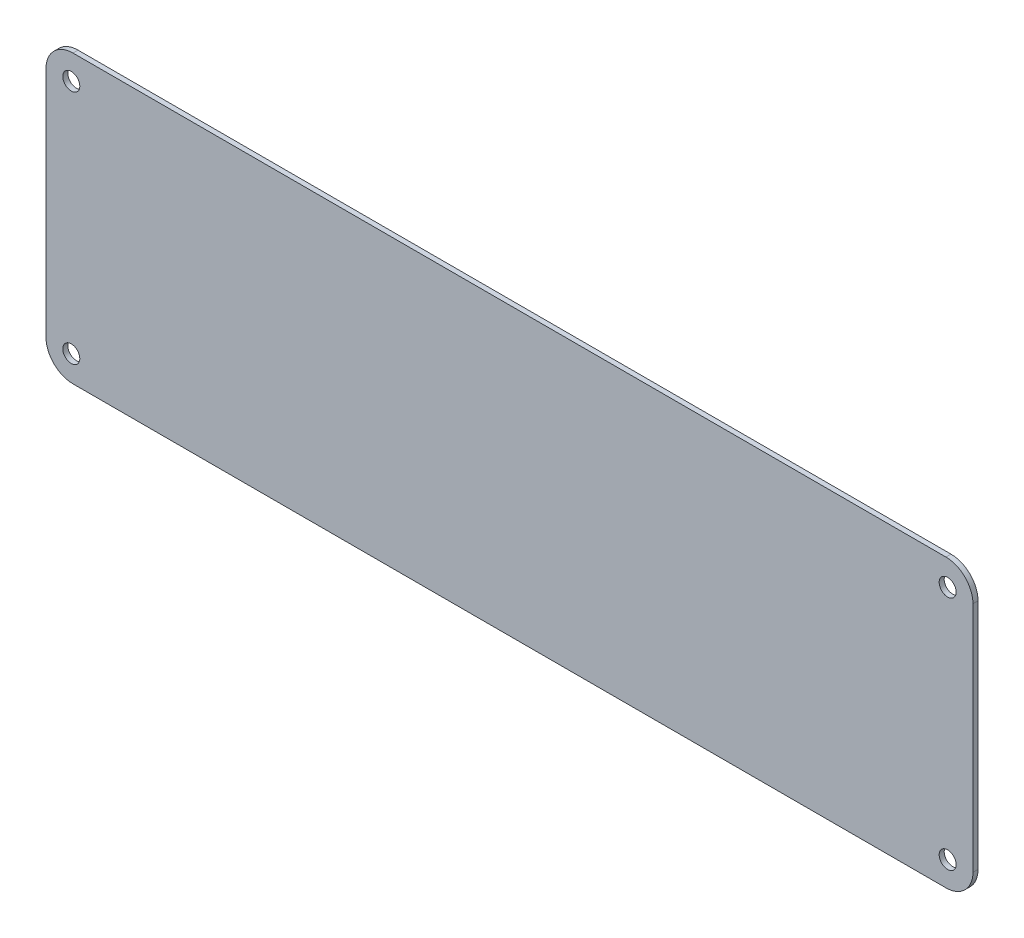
SolidWorks part; units mm, degrees
ref_plane "Ebene vorne" through (0, 0, 0) normal (0, 0, 1) x (1, 0, 0)
ref_plane "Ebene oben" through (0, 0, 0) normal (0, 1, 0) x (1, 0, 0)
ref_plane "Ebene rechts" through (0, 0, 0) normal (1, 0, 0) x (0, 0, -1)
sketch "Skizze1" plane through (0, 0, 0) normal (0, 0, 1) x (1, 0, 0)
  line L1 (-137.5, -42.5) -> (137.5, -42.5)
  line L2 (-137.5, -42.5) -> (-137.5, 42.5)
  line L3 (-137.5, 42.5) -> (137.5, 42.5)
  line L4 (137.5, -42.5) -> (137.5, 42.5)
  line L5 (-137.5, -42.5) -> (137.5, 42.5) construction
  line L6 (-137.5, 42.5) -> (137.5, -42.5) construction
  point P0 (0, 0)
  dimension "D1" = 275
  dimension "D2" = 85
extrude "Aufsatz-Linear austragen1" add sketch "Skizze1" along normal blind 1.5
hole_wizard "Ø5.05 (5.05) Durchmesser Bohrung1" positions "Skizze2" profile "Skizze3" hole size "Ø5.05" standard "DIN"
sketch "Skizze2" plane through (0, 0, 1.5) normal (0, 0, 1) x (1, 0, 0)
  line L1 (-130, -35) -> (130, -35)
  line L2 (-130, -35) -> (-130, 35)
  line L3 (-130, 35) -> (130, 35)
  line L4 (130, -35) -> (130, 35)
  line L5 (-130, -35) -> (130, 35) construction
  line L6 (-130, 35) -> (130, -35) construction
  point P2 (130, 35)
  point P5 (-130, -35)
  point P6 (-130, 35)
  point P7 (130, -35)
  dimension "D1" = 70
  dimension "D2" = 260
sketch "Skizze3" plane through (130, 35, 1.5) normal (1, 0, 0) x (0, -1, 0)
  line L0 (0, 0) -> (0, 1.5)
  line L1 (0, 1.5) -> (2.525, 1.5)
  line L2 (2.525, 1.5) -> (2.525, 0)
  line L5 (2.525, 0) -> (0, 0)
  line L11 (0, -6.35) -> (0, 107.95) construction
  dimension "Bohrerdurchmesser" = 5.05
  dimension "Bohrungstiefe" = 1.5
fillet "Verrundung1" radius 8
